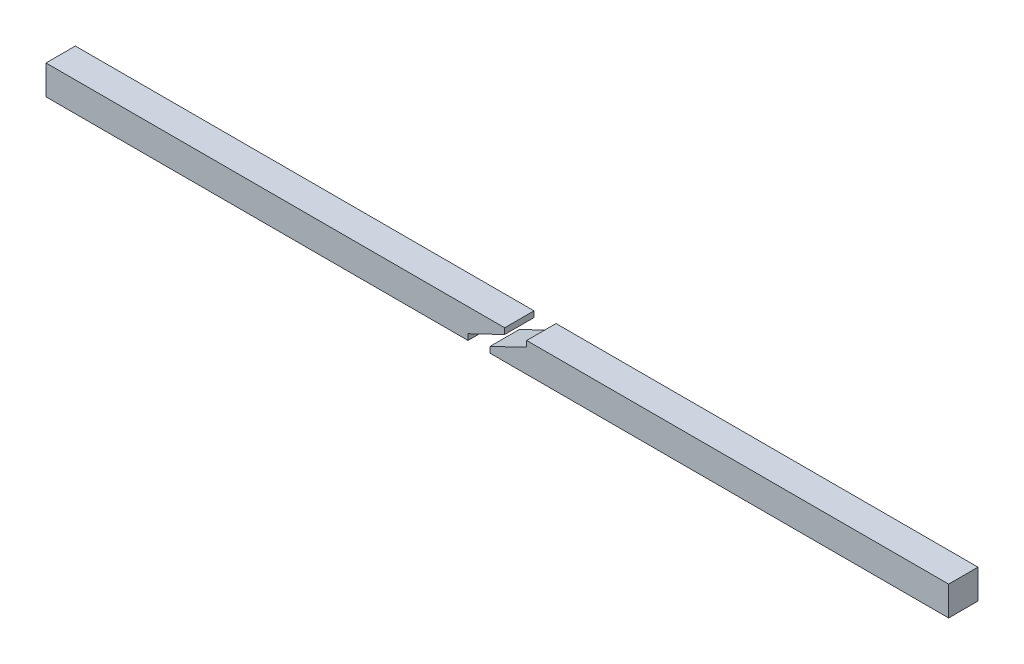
SolidWorks part; units mm, degrees
other "Widok rozstrzelony1"
other "Krok rozstrzelenia1"
other "Linia rozstrzelenia1"
ref_plane "Płaszczyzna przednia" through (0, 0, 0) normal (0, 0, 1) x (1, 0, 0)
ref_plane "Płaszczyzna górna" through (0, 0, 0) normal (0, 1, 0) x (1, 0, 0)
ref_plane "Płaszczyzna prawa" through (0, 0, 0) normal (1, 0, 0) x (0, 0, -1)
sketch "Szkic1" plane through (0, 0, 0) normal (0, 0, 1) x (1, 0, 0)
  line L0 (0, 0) -> (3125, 0)
  line L1 (2875, 0) -> (6000, 0)
  dimension "D1" = 250
  dimension "D2" = 6000
other "Więźba dachowa MURŁATA 200 X 200(1)"
ref_plane "Płaszczyzna1" through (0, 0, 0) normal (1, 0, 0) x (0, 1, 0)
sketch "Szkic11" plane through (0, 0, 0) normal (1, 0, 0) x (0, 1, 0)
  line L0 (0, 50) -> (0, -50) construction
  line L1 (100, -100) -> (-100, -100)
  line L2 (100, -100) -> (100, 100)
  line L3 (100, 100) -> (-100, 100)
  line L4 (-100, -100) -> (-100, 100)
  line L5 (100, -100) -> (-100, 100) construction
  line L6 (100, 100) -> (-100, -100) construction
  point P0 (0, 0)
  point P8 (0, 0)
  dimension "D1" = 200
  dimension "D2" = 200
  dimension "D3" = 50
other "Więźba dachowa MURŁATA 200 X 200(2)"
ref_plane "Płaszczyzna2" through (2875, 0, 0) normal (1, 0, 0) x (0, 1, 0)
sketch "Szkic12" plane through (2875, 0, 0) normal (1, 0, 0) x (0, 1, 0)
  line L0 (0, 50) -> (0, -50) construction
  line L1 (100, -100) -> (-100, -100)
  line L2 (100, -100) -> (100, 100)
  line L3 (100, 100) -> (-100, 100)
  line L4 (-100, -100) -> (-100, 100)
  line L5 (100, -100) -> (-100, 100) construction
  line L6 (100, 100) -> (-100, -100) construction
  point P0 (0, 0)
  point P8 (0, 0)
  dimension "D1" = 200
  dimension "D2" = 200
  dimension "D3" = 50
sketch "Szkic2" plane through (2837.1325, 28.4096, 100) normal (0, 0, 1) x (1, 0, 0)
  line L0 (37.8675, -128.4096) -> (287.8675, -128.4096)
  line L1 (287.8675, -128.4096) -> (287.8675, 31.5904)
  line L2 (287.8675, 31.5904) -> (37.8675, -88.4096)
  line L3 (37.8675, -88.4096) -> (37.8675, -128.4096)
  line L4 (162.8675, -28.4096) -> (287.8675, -28.4096) construction
  line L5 (287.8675, -128.4096) -> (287.8675, 71.5904) construction
  line L6 (-2837.1325, -128.4096) -> (287.8675, -128.4096) construction
  dimension "D1" = 40
  dimension "D2" = 250
extrude "Wytnij-wyciągnięcie1" cut sketch "Szkic2" against normal through all
other "Wycięcie zamka-prawe<1>"
sketch "Szkic3" plane through (3293.2397, -22.091, 100) normal (0, 0, 1) x (1, 0, 0)
  line L0 (-418.2397, -37.909) -> (-418.2397, 122.091)
  line L1 (-418.2397, 122.091) -> (-168.2397, 122.091)
  line L2 (-168.2397, 122.091) -> (-168.2397, 82.091)
  line L3 (-168.2397, 82.091) -> (-418.2397, -37.909)
  line L4 (-293.2397, 22.091) -> (-418.2397, 22.091) construction
  line L5 (-418.2397, -77.909) -> (-418.2397, 122.091) construction
  line L6 (-418.2397, 122.091) -> (2706.7603, 122.091) construction
  dimension "D1" = 250
  dimension "D2" = 40
extrude "Wytnij-wyciągnięcie2" cut sketch "Szkic3" against normal through all
other "Wycięcie zamka-lewe<1>"
move or copy body "Obiekt-Przenieś/Kopiuj1" bodies to move or copy 104 copy no translate (-150, 0, 0)
